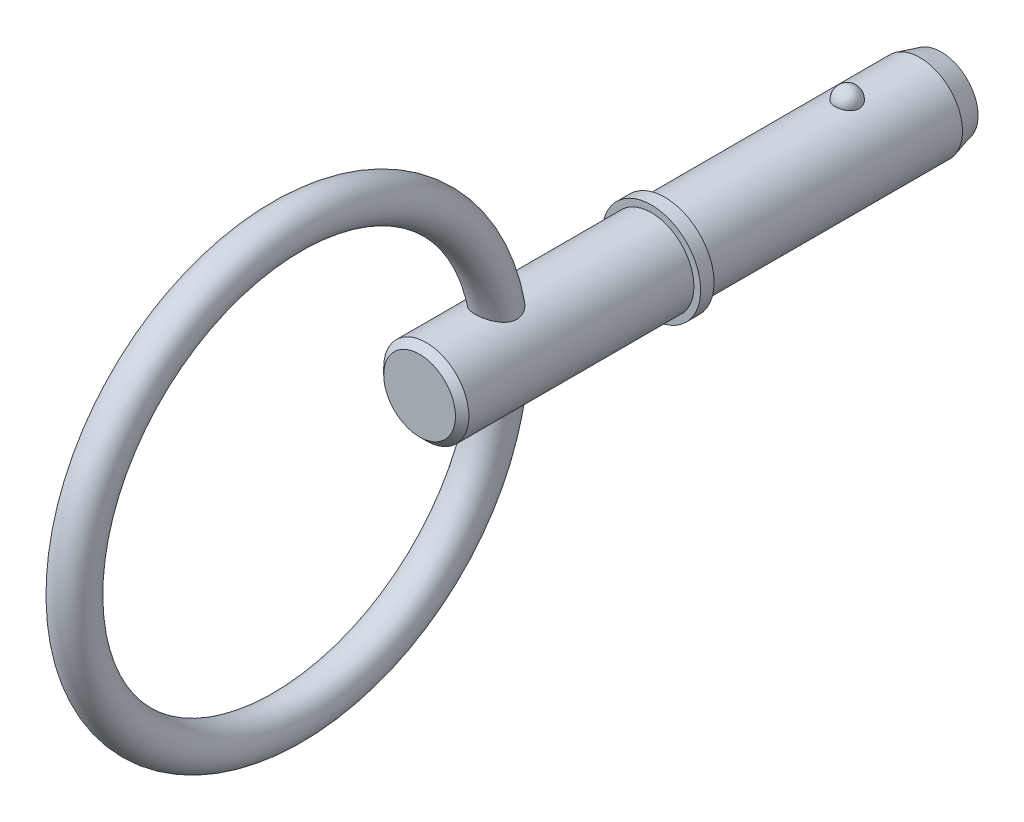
SolidWorks part; units mm, degrees
ref_plane "Front Plane" through (0, 0, 0) normal (0, 0, 1) x (1, 0, 0)
ref_plane "Top Plane" through (0, 0, 0) normal (0, 1, 0) x (1, 0, 0)
ref_plane "Right Plane" through (0, 0, 0) normal (1, 0, 0) x (0, 0, -1)
sketch "Sketch2" plane through (0, 0, 0) normal (0, 0, 1) x (1, 0, 0)
  circle A0 centre (0, 0) radius 3.175
  point P3 (0, 3.175)
  dimension "D1" = 6.35
extrude "Boss-Extrude1" add sketch "Sketch2" along normal blind 12.7
sketch "Sketch3" plane through (0, 0, 0) normal (0, 0, -1) x (-1, 0, 0)
  circle A0 centre (0, 0) radius 3.175
  dimension "D1" = 6.35
extrude "Boss-Extrude2" add sketch "Sketch3" along normal blind 7.92
chamfer "Chamfer1" distance 1.586 angle 15 1 edges at (-3.175, 0, -7.92)
sketch "Sketch18" plane through (0, 0, 0) normal (1, 0, 0) x (0, 0, -1)
  line L0 (6.334, 3.175) -> (-12.7, 3.175) construction
  line L1 (0.91, 4.085) -> (0.91, 2.265)
  line L2 (-12.7, -3.175) -> (6.334, -3.175) construction
  arc A0 (0.91, 4.085) -> (0.91, 2.265) centre (0.91, 3.175) ccw
  point P4 (0, 3.175)
  dimension "D1" = 7.26
revolve "Revolve1" add sketch "Sketch18" angle 360 about L1
sketch "Sketch19" plane through (0, 0, 0) normal (1, 0, 0) x (0, 0, -1)
  line L0 (-33.7288, 0) -> (-46.4542, 0) construction
sketch "Sketch20" plane through (0, 0, 0) normal (1, 0, 0) x (0, 0, -1)
  line L0 (-12.7, 0) -> (-12.7, 3.675)
  line L1 (-12.7, 3.175) -> (-12.7, -3.175) construction
  line L2 (-12.7, 3.675) -> (-13.7, 3.675)
  line L3 (-13.7, 3.675) -> (-13.7, 0)
  line L4 (-33.7288, 0) -> (-46.4542, 0) construction
  line L5 (-13.7, 0) -> (-12.7, 0)
  dimension "D1" = 3.675
  dimension "D2" = 1
revolve "Revolve2" add sketch "Sketch20" angle 360 about L0
sketch "Sketch21" plane through (0, 0, 12.7) normal (0, 0, -1) x (-1, 0, 0)
  circle A0 centre (0, 0) radius 3.175
  dimension "D1" = 6.35
extrude "Boss-Extrude3" add sketch "Sketch21" against normal blind 18.29
chamfer "Chamfer2" distance 0.5 angle 45 1 edges at (-3.175, 0, 30.99)
sketch "Sketch23" plane through (0, 0, 0) normal (1, 0, 0) x (0, 0, -1)
  line L0 (-30.99, 2.675) -> (-30.99, -2.675) construction
  circle A0 centre (-40.865, 0) radius 15.875
  point P2 (-24.99, 0)
  dimension "D1" = 31.75
  dimension "D2" = 6
sketch "Sketch24" plane through (0, 0, 0) normal (0, 1, 0) x (1, 0, 0)
  circle A0 centre (0, -24.99) radius 1.5
  dimension "D1" = 3
sweep "Sweep1" add profiles "Sketch24" path "Sketch23"
